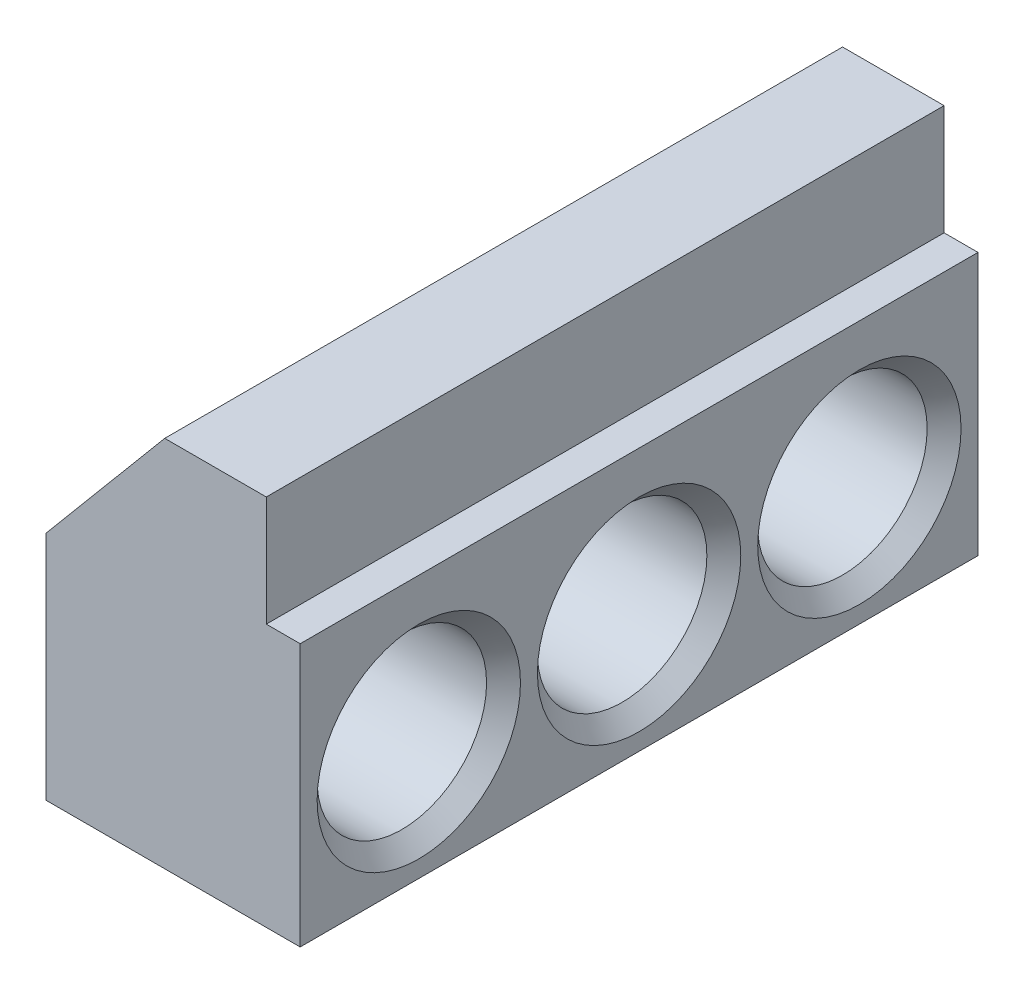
SolidWorks part; units mm, degrees
ref_plane "Face" through (0, 0, 0) normal (0, 0, 1) x (1, 0, 0)
ref_plane "Dessus" through (0, 0, 0) normal (0, 1, 0) x (1, 0, 0)
ref_plane "Droite" through (0, 0, 0) normal (1, 0, 0) x (0, 0, -1)
sketch "Esquisse3" plane through (0, 0, 0) normal (0, 0, 1) x (1, 0, 0)
  line L0 (7.0062, 22) -> (0, 13.65)
  line L1 (0, 0) -> (15, 0)
  line L2 (0, 0) -> (0, 13.65)
  line L3 (7.0062, 22) -> (15, 22)
  line L4 (15, 22) -> (15, 0)
  dimension "D1" = 15
  dimension "D3" = 13.65
  dimension "D4" = 10.9
extrude "Base-Extrusion" add sketch "Esquisse3" against normal blind 40
sketch "Esquisse4" plane through (0, 0, 0) normal (0, 0, 1) x (1, 0, 0)
  line L1 (15, 22) -> (13, 22)
  line L2 (15, 22) -> (15, 15.5)
  line L3 (15, 15.5) -> (13, 15.5)
  line L4 (13, 22) -> (13, 15.5)
  dimension "D1" = 2
  dimension "D2" = 6.5
extrude "Enlèv. mat.-Extru.1" cut sketch "Esquisse4" against normal through all
sketch "Esquisse5" plane through (15, 0, 0) normal (1, 0, 0) x (0, 0, -1)
  line L0 (40, 0) -> (0, 0) construction
  line L1 (0, 0) -> (0, 15.5) construction
  circle A0 centre (7, 7) radius 5
  circle A1 centre (33, 7) radius 5
  dimension "D1" = 10
  dimension "D2" = 10
  dimension "D3" = 7
  dimension "D4" = 7
  dimension "D5" = 26
  dimension "D6" = 7
extrude "Enlèv. mat.-Extru.2" cut sketch "Esquisse5" against normal through all
chamfer "Chanfrein1" distance 1 angle 45
sketch "Esquisse6" plane through (15, 0, 0) normal (1, 0, 0) x (0, 0, -1)
  line L0 (40, 13.65) -> (40, 0) construction
  line L1 (0, 0) -> (0, 15.5) construction
  circle A0 centre (20, 7) radius 5
  dimension "D1" = 10
  dimension "D2" = 20
extrude "Enlèv. mat.-Extru.3" cut sketch "Esquisse6" against normal blind 11
chamfer "Chanfrein2" distance 1 angle 45
sketch "Esquisse7" plane through (4, 0, 0) normal (1, 0, 0) x (0, 0, -1)
  circle A0 centre (20, 7) radius 3
extrude "Enlèv. mat.-Extru.4" cut sketch "Esquisse7" against normal through all
chamfer "Chanfrein3" distance 0.5 angle 45
